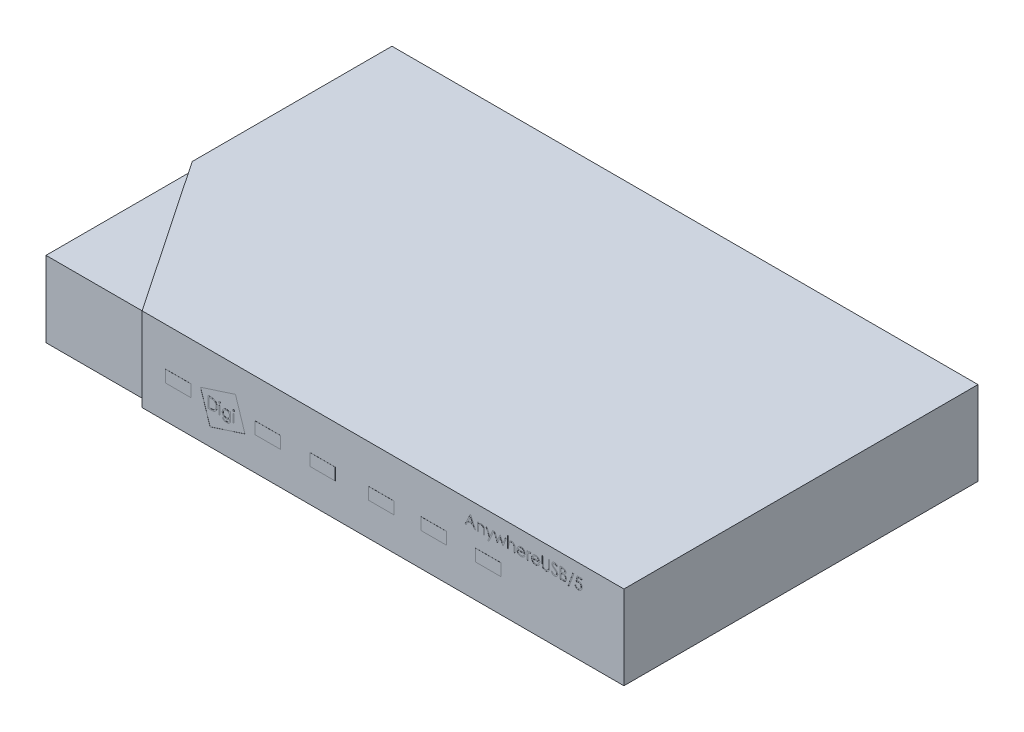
SolidWorks part; units mm, degrees
ref_plane "Front" through (0, 0, 0) normal (0, 0, 1) x (1, 0, 0)
ref_plane "Top" through (0, 0, 0) normal (0, 1, 0) x (1, 0, 0)
ref_plane "Right" through (0, 0, 0) normal (1, 0, 0) x (0, 0, -1)
sketch "Sketch1" plane through (0, 0, 0) normal (1, 0, 0) x (0, 0, -1)
  line L1 (0, 0) -> (110.49, 0)
  line L2 (0, 0) -> (0, 26.162)
  line L3 (0, 26.162) -> (110.49, 26.162)
  line L4 (110.49, 0) -> (110.49, 26.162)
  dimension "D1" = 110.49
  dimension "D2" = 26.162
extrude "Extrude1" add sketch "Sketch1" along normal blind 182.88
sketch "Sketch2" plane through (0, 0, 0) normal (0, 0, 1) x (1, 0, 0)
  line L0 (84.8884, 14.072) -> (92.8164, 14.072)
  line L1 (39.853, 14.072) -> (47.781, 14.072)
  line L2 (39.853, 14.072) -> (39.853, 10.3282)
  line L3 (39.853, 10.3282) -> (47.781, 10.3282)
  line L4 (47.781, 14.072) -> (47.781, 10.3282)
  line L5 (84.8884, 14.072) -> (84.8884, 10.3282)
  line L6 (84.8884, 10.3282) -> (92.8164, 10.3282)
  line L7 (92.8164, 14.072) -> (92.8164, 10.3282)
  line L8 (103.1668, 14.072) -> (111.0948, 14.072)
  line L9 (103.1668, 14.072) -> (103.1668, 10.3282)
  line L10 (103.1668, 10.3282) -> (111.0948, 10.3282)
  line L11 (111.0948, 14.072) -> (111.0948, 10.3282)
  line L12 (119.5733, 14.072) -> (127.5013, 14.072)
  line L13 (119.5733, 14.072) -> (119.5733, 10.3282)
  line L14 (119.5733, 10.3282) -> (127.5013, 10.3282)
  line L15 (127.5013, 14.072) -> (127.5013, 10.3282)
  line L16 (136.6405, 14.072) -> (144.5685, 14.072)
  line L17 (136.6405, 14.072) -> (136.6405, 10.3282)
  line L18 (136.6405, 10.3282) -> (144.5685, 10.3282)
  line L19 (144.5685, 14.072) -> (144.5685, 10.3282)
  line L20 (67.8212, 14.072) -> (75.7492, 14.072)
  line L21 (67.8212, 14.072) -> (67.8212, 10.3282)
  line L22 (67.8212, 10.3282) -> (75.7492, 10.3282)
  line L23 (75.7492, 14.072) -> (75.7492, 10.3282)
extrude "Extrude2" add sketch "Sketch2" along normal blind 0.0254
sketch "Sketch3"
extrude "Cut-Extrude1" cut sketch "Sketch3" against normal blind 0.0254
sketch "Sketch4" plane through (0, 0, 0) normal (0, 0, 1) x (1, 0, 0)
  line L0 (50.754, 14.6226) -> (61.655, 18.1461)
  line L1 (61.655, 18.1461) -> (64.6317, 8.9369)
  line L2 (64.6317, 8.9369) -> (53.7307, 5.4134)
  line L3 (53.7307, 5.4134) -> (50.754, 14.6226)
extrude "Cut-Extrude2" cut sketch "Sketch4" against normal blind 0.0254
sketch "Sketch5"
extrude "Extrude3" add sketch "Sketch5" along normal blind 0.0254
sketch "Sketch6" plane through (0, 26.162, 0) normal (0, 1, 0) x (1, 0, 0)
  line L0 (-4.527, 54.8641) -> (38.3344, -8.5799)
  line L1 (38.3344, -8.5799) -> (-4.527, -8.5799)
  line L2 (-4.527, -8.5799) -> (-4.527, 54.8641)
extrude "Cut-Extrude3" cut sketch "Sketch6" against normal blind 2.54
sketch "Sketch7" plane through (0, 0, 0) normal (0, 0, 1) x (1, 0, 0)
  line L1 (32.538, 23.622) -> (-6.4466, 23.622)
  line L2 (32.538, 23.622) -> (32.538, -3.1931)
  line L3 (32.538, -3.1931) -> (-6.4466, -3.1931)
  line L4 (-6.4466, 23.622) -> (-6.4466, -3.1931)
extrude "Cut-Extrude4" cut sketch "Sketch7" against normal blind 2.54
